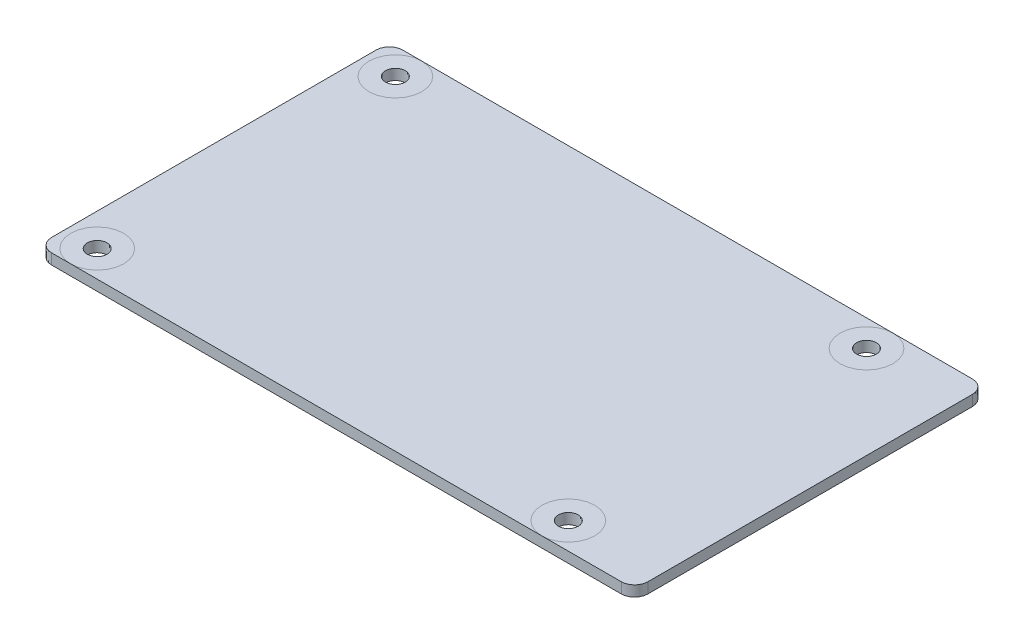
SolidWorks part; units mm, degrees
ref_plane "前基準面" through (0, 0, 0) normal (0, 0, 1) x (1, 0, 0)
ref_plane "上基準面" through (0, 0, 0) normal (0, 1, 0) x (1, 0, 0)
ref_plane "右基準面" through (0, 0, 0) normal (1, 0, 0) x (0, 0, -1)
imported_body "輸入1"
sketch "草圖1" plane through (0, 12.6, 0) normal (0, 1, 0) x (1, 0, 0)
  line L16 (51.8784, 18.0089) -> (56.5268, 15.6847)
  line L17 (56.5268, 15.6847) -> (61.654, 15.6847)
  line L18 (61.654, 15.6847) -> (66.3024, 18.0089)
  line L19 (66.3024, 18.0089) -> (66.3024, 23.2125)
  line L20 (66.3024, 23.2125) -> (61.654, 25.5367)
  line L21 (61.654, 25.5367) -> (56.5268, 25.5367)
  line L22 (56.5268, 25.5367) -> (51.8784, 23.2125)
  line L23 (51.8784, 23.2125) -> (51.8784, 18.0089)
  line L24 (51.8784, 18.0089) -> (56.5268, 15.6847)
  line L25 (56.5268, 15.6847) -> (61.654, 15.6847)
  line L26 (61.654, 15.6847) -> (66.3024, 18.0089)
  line L27 (66.3024, 18.0089) -> (66.3024, 23.2125)
  line L28 (66.3024, 23.2125) -> (61.654, 25.5367)
  line L29 (61.654, 25.5367) -> (56.5268, 25.5367)
  line L30 (56.5268, 25.5367) -> (51.8784, 23.2125)
  line L31 (51.8784, 23.2125) -> (51.8784, 18.0089)
  dimension "D1" = 0.1
extrude "除料-伸長1" cut sketch "草圖1" against normal blind 9
sketch "草圖2" plane through (0, 3.6, 0) normal (0, 1, 0) x (1, 0, 0)
  line L0 (56.5504, 25.4367) -> (61.6304, 15.7847) construction
  circle A0 centre (59.0904, 20.6107) radius 4.5
  dimension "D1" = 9
extrude "伸長1" add sketch "草圖2" along normal blind 10
fillet "圓角1" radius 0.5 5 edges at (59.0904, 13.6, -16.1107) (83.8145, 11.6, -32.2538) (69.6723, 11.6, -32.2538) (69.6723, 11.6, -18.1116) (83.8145, 11.6, -18.1116)
sketch "草圖3" plane through (0, 1.6, 0) normal (0, 1, 0) x (1, 0, 0)
  arc A0 (91.5, 35.3021) -> (91.5, 33.8021) centre (91.5, 34.5521) ccw construction
  arc A1 (91.5, 33.8021) -> (91.5, 35.3021) centre (91.5, 34.5521) ccw construction
  arc A2 (91.5, 30.2221) -> (91.5, 28.7221) centre (91.5, 29.4721) ccw construction
  arc A3 (91.5, 28.7221) -> (91.5, 30.2221) centre (91.5, 29.4721) ccw construction
  arc A4 (91.5, 35.3021) -> (91.5, 33.8021) centre (91.5, 34.5521) ccw
  arc A5 (91.5, 33.8021) -> (91.5, 35.3021) centre (91.5, 34.5521) ccw
  arc A6 (91.5, 30.2221) -> (91.5, 28.7221) centre (91.5, 29.4721) ccw
  arc A7 (91.5, 28.7221) -> (91.5, 30.2221) centre (91.5, 29.4721) ccw
extrude "伸長2" add sketch "草圖3" against normal up to surface (1.6 mm away)
sketch "草圖4" plane through (0, 31.6, 0) normal (0, 1, 0) x (1, 0, 0)
  line L4 (-0.4195, 41.9978) -> (-0.4195, 19.7976)
  line L5 (-0.4195, 19.7976) -> (9.3803, 19.7976)
  line L6 (9.3803, 19.7976) -> (9.3803, 41.9978)
  line L7 (9.3803, 41.9978) -> (-0.4195, 41.9978)
  line L8 (-0.4195, 41.9978) -> (-0.4195, 19.7976)
  line L9 (-0.4195, 19.7976) -> (9.3803, 19.7976)
  line L10 (9.3803, 19.7976) -> (9.3803, 41.9978)
  line L11 (9.3803, 41.9978) -> (-0.4195, 41.9978)
  dimension "D1" = 0
extrude "除料-伸長2" cut sketch "草圖4" against normal blind 5
sketch "草圖5" plane through (0, 0, -50.0747) normal (0, 0, -1) x (-1, 0, 0)
  line L4 (-15.9104, 20.6) -> (-26.0704, 20.6)
  line L5 (-26.0704, 20.6) -> (-26.0704, 1.6)
  line L6 (-26.0704, 1.6) -> (-15.9104, 1.6)
  line L7 (-15.9104, 1.6) -> (-15.9104, 20.6)
  line L8 (-15.9104, 20.6) -> (-26.0704, 20.6)
  line L9 (-26.0704, 20.6) -> (-26.0704, 1.6)
  line L10 (-26.0704, 1.6) -> (-15.9104, 1.6)
  line L11 (-15.9104, 1.6) -> (-15.9104, 20.6)
  line L12 (-33.6904, 20.6) -> (-43.8504, 20.6)
  line L13 (-43.8504, 20.6) -> (-43.8504, 1.6)
  line L14 (-43.8504, 1.6) -> (-33.6904, 1.6)
  line L15 (-33.6904, 1.6) -> (-33.6904, 20.6)
  line L16 (-33.6904, 20.6) -> (-43.8504, 20.6)
  line L17 (-43.8504, 20.6) -> (-43.8504, 1.6)
  line L18 (-43.8504, 1.6) -> (-33.6904, 1.6)
  line L19 (-33.6904, 1.6) -> (-33.6904, 20.6)
  dimension "D1" = 0
  dimension "D2" = 0
extrude "除料-伸長3" cut sketch "草圖5" against normal blind 0.2
sketch "草圖6" plane through (0, 0, 0) normal (0, -1, 0) x (1, 0, 0)
  circle A0 centre (1.63, -3.23) radius 2.75
  circle A1 centre (1.63, -46.77) radius 2.75
  circle A2 centre (96.77, -46.77) radius 2.75
  circle A3 centre (96.77, -3.23) radius 2.75
  dimension "D1" = 5.5
extrude "除料-伸長4" cut sketch "草圖6" against normal blind 0.0001
sketch "草圖7" plane through (0, 1.6, 0) normal (0, 1, 0) x (1, 0, 0)
  circle A1 centre (96.77, 3.23) radius 2.75
  circle A2 centre (96.77, 3.23) radius 2.75
  circle A3 centre (96.77, 46.77) radius 2.75
  circle A4 centre (96.77, 46.77) radius 2.75
  circle A5 centre (1.63, 46.77) radius 2.75
  circle A6 centre (1.63, 46.77) radius 2.75
  circle A7 centre (1.63, 3.23) radius 2.75
  circle A8 centre (1.63, 3.23) radius 2.75
  dimension "D1" = 0
  dimension "D2" = 0
  dimension "D3" = 0
  dimension "D4" = 0
extrude "除料-伸長5" cut sketch "草圖7" against normal blind 0.0001
sketch "草圖8" plane through (0, 0, -49.8747) normal (0, 0, 1) x (1, 0, 0)
  line L4 (43.8504, 13.6) -> (33.6904, 13.6)
  line L5 (33.6904, 13.6) -> (33.6904, 1.6)
  line L6 (33.6904, 1.6) -> (43.8504, 1.6)
  line L7 (43.8504, 1.6) -> (43.8504, 13.6)
  line L8 (43.8504, 13.6) -> (33.6904, 13.6)
  line L9 (33.6904, 13.6) -> (33.6904, 1.6)
  line L10 (33.6904, 1.6) -> (43.8504, 1.6)
  line L11 (43.8504, 1.6) -> (43.8504, 13.6)
  line L12 (26.0704, 13.6) -> (15.9104, 13.6)
  line L13 (15.9104, 13.6) -> (15.9104, 1.6)
  line L14 (15.9104, 1.6) -> (26.0704, 1.6)
  line L15 (26.0704, 1.6) -> (26.0704, 13.6)
  line L16 (26.0704, 13.6) -> (15.9104, 13.6)
  line L17 (15.9104, 13.6) -> (15.9104, 1.6)
  line L18 (15.9104, 1.6) -> (26.0704, 1.6)
  line L19 (26.0704, 1.6) -> (26.0704, 13.6)
  dimension "D1" = 0
  dimension "D2" = 0
extrude "伸長3" add sketch "草圖8" along normal blind 4.5
sketch "草圖9" plane through (0, 1.6, 0) normal (0, 1, 0) x (1, 0, 0)
  line L0 (43.8504, 48.7947) -> (43.8504, 45.3747) construction
  line L1 (33.6904, 45.3747) -> (43.8504, 45.3747) construction
  line L2 (33.6904, 45.3747) -> (33.6904, 48.7947) construction
  line L3 (43.8504, 49.8747) -> (33.6904, 49.8747) construction
  line L4 (15.9104, 49.8747) -> (26.0704, 49.8747) construction
  line L5 (26.0704, 49.8747) -> (26.0704, 45.3747) construction
  line L6 (15.9104, 45.3747) -> (15.9104, 48.7947) construction
  line L7 (15.9104, 45.3747) -> (26.0704, 45.3747) construction
  line L8 (43.8504, 49.8747) -> (43.8504, 45.3747) construction
  line L9 (33.6904, 45.3747) -> (43.8504, 45.3747) construction
  line L10 (33.6904, 45.3747) -> (33.6904, 49.8747) construction
  line L11 (43.8504, 49.8747) -> (33.6904, 49.8747) construction
  line L12 (15.9104, 49.8747) -> (26.0704, 49.8747) construction
  line L13 (26.0704, 49.8747) -> (26.0704, 45.3747) construction
  line L14 (15.9104, 45.3747) -> (15.9104, 49.8747) construction
  line L15 (15.9104, 45.3747) -> (26.0704, 45.3747) construction
  line L16 (44.2004, 49.7247) -> (44.2004, 45.5247)
  line L17 (33.8404, 45.0247) -> (43.7004, 45.0247)
  line L18 (33.3404, 45.5247) -> (33.3404, 49.7247)
  line L19 (43.7004, 50.2247) -> (33.8404, 50.2247)
  line L20 (16.0604, 50.2247) -> (25.9204, 50.2247)
  line L21 (26.4204, 49.7247) -> (26.4204, 45.5247)
  line L22 (16.0604, 45.0247) -> (25.9204, 45.0247)
  line L23 (15.5604, 45.5247) -> (15.5604, 49.7247)
  line L24 (44.0004, 49.7247) -> (44.0004, 45.5247)
  line L25 (33.8404, 45.2247) -> (43.7004, 45.2247)
  line L26 (33.5404, 45.5247) -> (33.5404, 49.7247)
  line L27 (43.7004, 50.0247) -> (33.8404, 50.0247)
  line L28 (16.0604, 50.0247) -> (25.9204, 50.0247)
  line L29 (26.2204, 49.7247) -> (26.2204, 45.5247)
  line L30 (16.0604, 45.2247) -> (25.9204, 45.2247)
  line L31 (15.7604, 45.5247) -> (15.7604, 49.7247)
  line L32 (15.7604, 50.0247) -> (26.2204, 50.0247) construction
  line L33 (15.7604, 45.2247) -> (15.7604, 50.0247) construction
  line L34 (15.7604, 45.2247) -> (26.2204, 45.2247) construction
  line L35 (26.2204, 50.0247) -> (26.2204, 45.2247) construction
  line L36 (33.5404, 45.2247) -> (33.5404, 50.0247) construction
  line L37 (44.0004, 50.0247) -> (33.5404, 50.0247) construction
  line L38 (33.5404, 45.2247) -> (44.0004, 45.2247) construction
  line L39 (44.0004, 50.0247) -> (44.0004, 45.2247) construction
  line L40 (44.2004, 50.2247) -> (44.2004, 45.0247) construction
  line L41 (44.2004, 50.2247) -> (33.3404, 50.2247) construction
  line L42 (33.3404, 45.0247) -> (44.2004, 45.0247) construction
  line L43 (33.3404, 45.0247) -> (33.3404, 50.2247) construction
  line L44 (26.4204, 50.2247) -> (26.4204, 45.0247) construction
  line L45 (15.5604, 50.2247) -> (26.4204, 50.2247) construction
  line L46 (15.5604, 45.0247) -> (26.4204, 45.0247) construction
  line L47 (15.5604, 45.0247) -> (15.5604, 50.2247) construction
  arc A0 (16.0604, 50.0247) -> (15.7604, 49.7247) centre (16.0604, 49.7247) ccw
  arc A1 (16.0604, 45.2247) -> (15.7604, 45.5247) centre (16.0604, 45.5247) cw
  arc A2 (25.9204, 45.2247) -> (26.2204, 45.5247) centre (25.9204, 45.5247) ccw
  arc A3 (25.9204, 50.0247) -> (26.2204, 49.7247) centre (25.9204, 49.7247) cw
  arc A4 (33.5404, 49.7247) -> (33.8404, 50.0247) centre (33.8404, 49.7247) cw
  arc A5 (33.5404, 45.5247) -> (33.8404, 45.2247) centre (33.8404, 45.5247) ccw
  arc A6 (43.7004, 45.2247) -> (44.0004, 45.5247) centre (43.7004, 45.5247) ccw
  arc A7 (44.0004, 49.7247) -> (43.7004, 50.0247) centre (43.7004, 49.7247) ccw
  arc A8 (44.2004, 49.7247) -> (43.7004, 50.2247) centre (43.7004, 49.7247) ccw
  arc A9 (44.2004, 45.5247) -> (43.7004, 45.0247) centre (43.7004, 45.5247) cw
  arc A10 (33.3404, 49.7247) -> (33.8404, 50.2247) centre (33.8404, 49.7247) cw
  arc A11 (33.8404, 45.0247) -> (33.3404, 45.5247) centre (33.8404, 45.5247) cw
  arc A12 (26.4204, 49.7247) -> (25.9204, 50.2247) centre (25.9204, 49.7247) ccw
  arc A13 (25.9204, 45.0247) -> (26.4204, 45.5247) centre (25.9204, 45.5247) ccw
  arc A14 (15.5604, 49.7247) -> (16.0604, 50.2247) centre (16.0604, 49.7247) cw
  arc A15 (16.0604, 45.0247) -> (15.5604, 45.5247) centre (16.0604, 45.5247) cw
  dimension "D3" = 0.3
  dimension "D4" = 0.5
  dimension "D1" = 0.35
  dimension "D2" = 0.15
extrude "伸長4" [suppressed] add sketch "草圖9" along normal blind 20
sketch "草圖10" plane through (0, 26.6, 0) normal (0, 1, 0) x (1, 0, 0)
  line L4 (9.3803, 41.9978) -> (-0.4195, 41.9978)
  line L5 (-0.4195, 41.9978) -> (-0.4195, 19.7976)
  line L6 (-0.4195, 19.7976) -> (9.3803, 19.7976)
  line L7 (9.3803, 19.7976) -> (9.3803, 41.9978)
  line L8 (9.3803, 41.9978) -> (-0.4195, 41.9978)
  line L9 (-0.4195, 41.9978) -> (-0.4195, 19.7976)
  line L10 (-0.4195, 19.7976) -> (9.3803, 19.7976)
  line L11 (9.3803, 19.7976) -> (9.3803, 41.9978)
  dimension "D1" = 0
extrude "除料-伸長6" cut sketch "草圖10" against normal blind 15
sketch "草圖11" plane through (0, 1.6, 0) normal (0, 1, 0) x (1, 0, 0)
  circle A0 centre (96.77, 46.77) radius 2.75 construction
  circle A1 centre (1.63, 46.77) radius 2.75 construction
  circle A2 centre (1.63, 3.23) radius 2.75 construction
  circle A3 centre (96.77, 46.77) radius 2.75
  circle A4 centre (1.63, 46.77) radius 2.75
  circle A5 centre (1.63, 3.23) radius 2.75
  circle A6 centre (96.77, 3.23) radius 2.75 construction
  circle A7 centre (96.77, 3.23) radius 2.75
extrude "除料-伸長7" cut sketch "草圖11" against normal through all and the other way through all
sketch "草圖12" plane through (0, 1.6, 0) normal (0, 1, 0) x (1, 0, 0)
  circle A0 centre (96.77, 3.23) radius 2.75 construction
  circle A1 centre (1.63, 3.23) radius 2.75
  circle A2 centre (1.63, 3.23) radius 2.75
  circle A3 centre (1.63, 46.77) radius 2.75
  circle A4 centre (1.63, 46.77) radius 2.75
  circle A5 centre (96.77, 46.77) radius 2.75
  circle A6 centre (96.77, 46.77) radius 2.75
  circle A7 centre (96.77, 3.23) radius 2.75
  dimension "D1" = 0
  dimension "D2" = 0
  dimension "D3" = 0
extrude "填料-伸長1" add sketch "草圖12" against normal up to surface (1.6 mm away)
sketch "草圖13" plane through (100, 0, 0) normal (1, 0, 0) x (0, 0, -1)
  line L4 (50, 0) -> (50, 1.6)
  line L5 (50, 1.6) -> (0, 1.6)
  line L6 (0, 1.6) -> (0, 0)
  line L7 (0, 0) -> (50, 0)
  line L8 (50, 0) -> (50, 1.6)
  line L9 (50, 1.6) -> (0, 1.6)
  line L10 (0, 1.6) -> (0, 0)
  line L11 (0, 0) -> (50, 0)
  dimension "D1" = 0
extrude "除料-伸長8" cut sketch "草圖13" against normal blind 2
sketch "草圖21" plane through (0, 1.6, 0) normal (0, 1, 0) x (1, 0, 0)
  line L1 (8, 0) -> (98, 0)
  line L2 (8, 0) -> (8, -3)
  line L3 (8, -3) -> (98, -3)
  line L4 (98, 0) -> (98, -3)
  dimension "D1" = 3
extrude "填料-伸長2" add sketch "草圖21" against normal up to surface (1.6 mm away)
fillet "圓角2" radius 2 3 edges at (-1.6, 0.8, 0) (-1.6, 0.8, -50) (98, 0.8, -50)
sketch "草圖14" plane through (0, 22.6, 0) normal (0, 1, 0) x (1, 0, 0)
  circle A0 centre (46.5573, 33.3107) radius 6.2499
  circle A1 centre (59.6383, 33.3107) radius 6.2499
extrude "除料-伸長9" cut sketch "草圖14" against normal blind 5
fillet "圓角3" radius 1 4 edges at (53.3884, 17.6, -33.3107) (40.3074, 17.6, -33.3107) (65.8882, 17.6, -33.3107) (52.8072, 17.6, -33.3107)
sketch "草圖15" plane through (0, 1.6, 0) normal (0, 1, 0) x (1, 0, 0)
  line L4 (-1.6, 48) -> (-1.6, 2)
  line L5 (0.4, 0) -> (8, 0)
  line L6 (98, -3) -> (98, 48)
  line L7 (96, 50) -> (0.4, 50)
  line L8 (-1.6, 48) -> (-1.6, 2)
  line L9 (0.4, 0) -> (8, 0)
  line L10 (98, -3) -> (98, 48)
  line L11 (96, 50) -> (0.4, 50)
  line L14 (8, 0) -> (8, -3)
  line L15 (8, 0) -> (8, -3)
  line L16 (8, -3) -> (98, -3)
  line L17 (8, -3) -> (98, -3)
  arc A4 (-1.6, 2) -> (0.4, 0) centre (0.4, 2) ccw
  arc A6 (98, 48) -> (96, 50) centre (96, 48) ccw
  arc A7 (0.4, 50) -> (-1.6, 48) centre (0.4, 48) ccw
  arc A8 (-1.6, 2) -> (0.4, 0) centre (0.4, 2) ccw
  arc A10 (98, 48) -> (96, 50) centre (96, 48) ccw
  arc A11 (0.4, 50) -> (-1.6, 48) centre (0.4, 48) ccw
  dimension "D1" = 0
extrude "除料-伸長10" cut sketch "草圖15" along normal blind 53
sketch "草圖16" plane through (0, 1.6, 0) normal (0, 1, 0) x (1, 0, 0)
  line L0 (96, 50) -> (0.4, 50) construction
  line L1 (98, 48) -> (98, -3) construction
  line L3 (-1.6, 48) -> (-1.6, 2) construction
  line L4 (8, -3) -> (98, -3) construction
  circle A0 centre (84, 46) radius 1.5
  circle A1 centre (84, 1) radius 1.5
  circle A2 centre (12.9, 1) radius 1.5
  circle A3 centre (12.9, 46) radius 1.5
  circle A4 centre (84, 46) radius 4
  circle A5 centre (84, 1) radius 4
  circle A6 centre (12.9, 46) radius 4
  circle A7 centre (12.9, 1) radius 4
  dimension "D1" = 3
  dimension "D4" = 8
  dimension "D2" = 4
  dimension "D3" = 14
  dimension "D5" = 4
  dimension "D6" = 14.5
sketch "草圖17" plane through (0, 1.6, 0) normal (0, 1, 0) x (1, 0, 0)
  circle A0 centre (84, 46) radius 1.5 construction
  circle A1 centre (84, 1) radius 1.5 construction
  circle A2 centre (12.9, 1) radius 1.5 construction
  circle A3 centre (12.9, 46) radius 1.5 construction
  circle A4 centre (84, 46) radius 1.5
  circle A5 centre (84, 1) radius 1.5
  circle A6 centre (12.9, 1) radius 1.5
  circle A7 centre (12.9, 46) radius 1.5
extrude "除料-伸長11" cut sketch "草圖17" against normal blind 10
sketch "草圖18" plane through (0, 1.6, 0) normal (0, 1, 0) x (1, 0, 0)
  circle A0 centre (84, 46) radius 4 construction
  circle A1 centre (12.9, 46) radius 4 construction
  circle A2 centre (12.9, 1) radius 4 construction
  circle A3 centre (84, 1) radius 4 construction
  circle A4 centre (84, 46) radius 4
  circle A5 centre (12.9, 46) radius 4
  circle A6 centre (12.9, 1) radius 4
  circle A7 centre (84, 1) radius 4
extrude "除料-伸長12" cut sketch "草圖18" against normal blind 0.0001
sketch "草圖20" plane through (0, 1.6, 0) normal (0, 1, 0) x (1, 0, 0)
  line L0 (0.4, 0) -> (8, 0) construction
  line L1 (8, 0) -> (8, 50)
  line L2 (98, 48) -> (98, -3) construction
  line L7 (96, 50) -> (84, 50) construction
  line L8 (-1.6, 48) -> (-1.6, 2) construction
  line L9 (8, 50) -> (-1.6, 50)
  line L11 (8, 0) -> (-1.6, 0)
  line L12 (-1.6, 50) -> (-1.6, 0)
  dimension "D1" = 90
extrude "除料-伸長13" cut sketch "草圖20" against normal blind 10
sketch "草圖22" plane through (0, 0, 0) normal (0, -1, 0) x (1, 0, 0)
  circle A0 centre (12.9, -1) radius 4 construction
  circle A1 centre (84, -1) radius 4 construction
  circle A2 centre (84, -46) radius 4 construction
  circle A3 centre (12.9, -46) radius 4 construction
  circle A4 centre (12.9, -1) radius 4
  circle A5 centre (84, -1) radius 4
  circle A6 centre (84, -46) radius 4
  circle A7 centre (12.9, -46) radius 4
extrude "除料-伸長14" cut sketch "草圖22" against normal blind 0.0001
sketch "BOTTON-1" plane through (0, 0, 0) normal (0, -1, 0) x (1, 0, 0)
  line L0 (86.9456, -50.0034) -> (86.9456, -48.7062)
  line L1 (86.9456, -50.0034) -> (95.6544, -50.0034)
  line L2 (86.9456, -43.2938) -> (86.9456, -39.9966)
  line L3 (86.9456, -39.9966) -> (95.6544, -39.9966)
  line L4 (95.6544, -50.0034) -> (95.6544, -39.9966)
  circle A1 centre (84, -46) radius 4 construction
  arc A2 (86.9456, -48.7062) -> (86.9456, -43.2938) centre (84, -46) ccw
sketch "BOTTON VIEW" plane through (0, 0, 0) normal (0, -1, 0) x (1, 0, 0)
  text T0 "H=3.0mm  BOTTON VIEW"
  text T1 "H=0" font "Century Gothic" height in points 7
sketch "TOP VIEW" plane through (0, 1.6, 0) normal (0, 1, 0) x (1, 0, 0)
  text T0 "H=11.0mm  TOP VIEW"
sketch "TOP VIEW-1" plane through (0, 1.6, 0) normal (0, 1, 0) x (1, 0, 0)
  text T0 "H=6.0" font "Century Gothic" height in points 10
  text T1 "H=16" font "Century Gothic" height in points 10
sketch "TOP VIEW-2" plane through (0, 1.6, 0) normal (0, 1, 0) x (1, 0, 0)
  line L0 (88.5, -3) -> (88.5, 50)
  line L2 (96, 50) -> (84, 50) construction
  line L3 (98, 48) -> (98, -3) construction
  line L5 (98, 11) -> (88.5, 11)
  line L6 (98, 11) -> (98, 5)
  line L7 (98, 5) -> (88.5, 5)
  line L8 (88.5, 11) -> (88.5, 5)
  dimension "D1" = 9.5
  dimension "D3" = 6
fillet "圓角4" radius 2 3 edges at (8, 0.8, -50) (98, 0.8, 3) (8, 0.8, 3)
